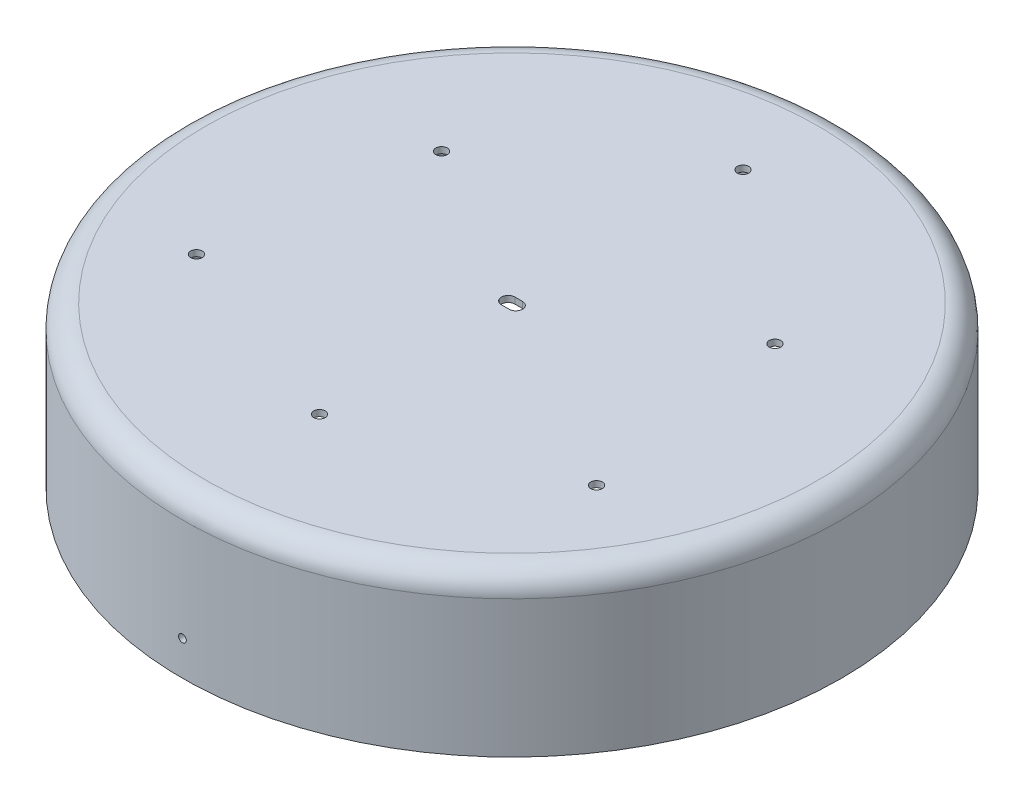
SolidWorks part; units mm, degrees
ref_plane "Спереди" through (0, 0, 0) normal (0, 0, 1) x (1, 0, 0)
ref_plane "Сверху" through (0, 0, 0) normal (0, 1, 0) x (1, 0, 0)
ref_plane "Справа" through (0, 0, 0) normal (1, 0, 0) x (0, 0, -1)
sketch "Эскиз1" plane through (0, 0, 0) normal (0, 0, 1) x (1, 0, 0)
  line L0 (0, 41.6) -> (-79.6, 41.6)
  line L1 (-85.6, 35.6) -> (-85.6, 0)
  line L2 (-85.6, 0) -> (-84, 0)
  line L3 (-84, 0) -> (-84, 36)
  line L4 (-80, 40) -> (0, 40)
  line L5 (0, 40) -> (0, 41.6)
  line L6 (0, 50.6009) -> (0, 4.2699) construction
  arc A0 (-79.6, 41.6) -> (-85.6, 35.6) centre (-79.6, 35.6) ccw
  arc A1 (-84, 36) -> (-80, 40) centre (-80, 36) cw
  point P13 (-84, 40)
  dimension "D6" = 6
  dimension "D7" = 4
  dimension "D1" = 84
  dimension "D2" = 40
  dimension "D3" = 1.6
  dimension "D4" = 1.6
  dimension "D5" = 0
revolve "Повернуть1" add sketch "Эскиз1" angle 360 about L6
sketch "Эскиз2" plane through (0, 41.6, 0) normal (0, 1, 0) x (1, 0, 0)
  line L0 (-1, 0) -> (1, 0) construction
  line L1 (-1, 1.75) -> (1, 1.75)
  line L2 (-1, -1.75) -> (1, -1.75)
  circle A0 centre (0, 0) radius 60 construction
  circle A1 centre (0, 60) radius 1.5
  circle A2 centre (51.9615, -30) radius 1.5
  circle A3 centre (-51.9615, -30) radius 1.5
  circle A4 centre (0, 0) radius 50 construction
  circle A6 centre (43.3013, 25) radius 1.5
  circle A8 centre (0, -50) radius 1.5
  circle A10 centre (-43.3013, 25) radius 1.5
  arc A13 (-1, 1.75) -> (-1, -1.75) centre (-1, 0) ccw
  arc A14 (1, -1.75) -> (1, 1.75) centre (1, 0) ccw
  point P11 (0, 0)
  point P13 (0, 0)
  point P26 (0, 0)
  dimension "D1" = 3
  dimension "D3" = 120
  dimension "D4" = 100
  dimension "D5" = 5.5
  dimension "D6" = 3.5
  dimension "D7" = 0
  dimension "D2" = 3
extrude "Вырез-Вытянуть1" cut sketch "Эскиз2" against normal blind 10
sketch "Эскиз4" plane through (0, 0, 0) normal (0, 0, 1) x (1, 0, 0)
  line L0 (-85.6, 0) -> (85.6, 0) construction
  circle A0 centre (0, 9) radius 1
  dimension "D1" = 2
  dimension "D2" = 9
extrude "Вырез-Вытянуть2" cut sketch "Эскиз4" against normal through all both and the other way through all
